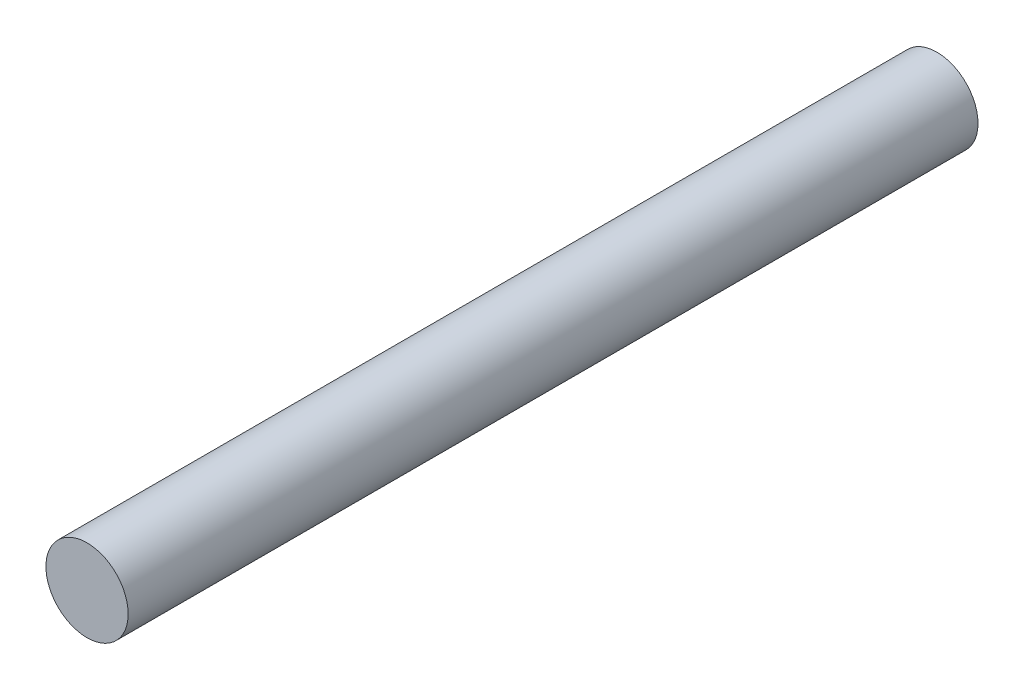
SolidWorks part; units mm, degrees
ref_plane "Face" through (0, 0, 0) normal (0, 0, 1) x (1, 0, 0)
ref_plane "Dessus" through (0, 0, 0) normal (0, 1, 0) x (1, 0, 0)
ref_plane "Droite" through (0, 0, 0) normal (1, 0, 0) x (0, 0, -1)
sketch "Esquisse1" plane through (0, 0, 0) normal (0, 0, 1) x (1, 0, 0)
  circle A0 centre (0, 0) radius 1.5
  dimension "D1" = 3
extrude "Base-Extrusion" add sketch "Esquisse1" along normal blind 31
